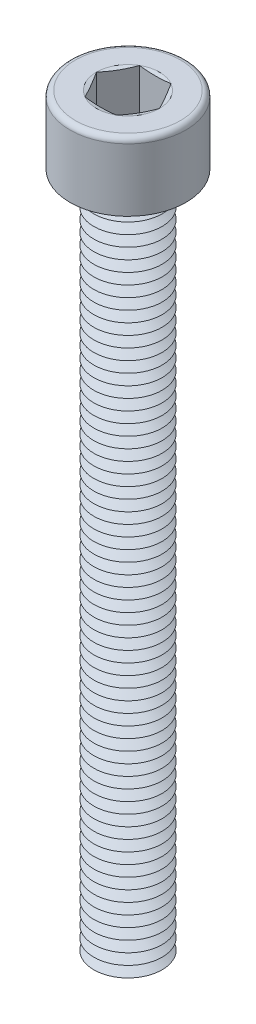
SolidWorks part; units mm, degrees
ref_plane "Front Plane" through (0, 0, 0) normal (0, 0, 1) x (1, 0, 0)
ref_plane "Top Plane" through (0, 0, 0) normal (0, 1, 0) x (1, 0, 0)
ref_plane "Right Plane" through (0, 0, 0) normal (1, 0, 0) x (0, 0, -1)
sketch "Sketch1" plane through (0, 0, 0) normal (0, 1, 0) x (1, 0, 0)
  circle A0 centre (0, 0) radius 2.5
  dimension "D1" = 5
extrude "Extrude1" add sketch "Sketch1" along normal blind 50
sketch "Sketch2" plane through (0, 50, 0) normal (0, 1, 0) x (1, 0, 0)
  circle A0 centre (0, 0) radius 4.25
  dimension "D1" = 8.5
extrude "Extrude2" add sketch "Sketch2" along normal blind 5
sketch "Sketch3" plane through (0, 55, 0) normal (0, 1, 0) x (1, 0, 0)
  line L1 (1.1547, 2) -> (-1.1547, 2)
  line L2 (-1.1547, 2) -> (-2.3094, 0)
  line L3 (-2.3094, 0) -> (-1.1547, -2)
  line L4 (-1.1547, -2) -> (1.1547, -2)
  line L5 (1.1547, -2) -> (2.3094, 0)
  line L6 (2.3094, 0) -> (1.1547, 2)
  circle A0 centre (0, 0) radius 2 construction
  dimension "D1" = 4
extrude "Extrude3" cut sketch "Sketch3" against normal blind 4
fillet "Fillet1" radius 0.4 1 edges at (0, 55, 4.25)
sketch "Sketch4" plane through (0, 0, 0) normal (1, 0, 0) x (0, 0, -1)
  line L0 (-2, 51) -> (0, 51)
  line L1 (0, 51) -> (0, 49.8453)
  line L2 (0, 49.8453) -> (-2, 51)
  dimension "D1" = 30
revolve "Cut-Revolve1" cut sketch "Sketch4" angle 360 about L1
sketch "Sketch5" plane through (0, 0, 0) normal (0, 0, 1) x (1, 0, 0)
  line L0 (-2.5, 0.4) -> (-2.5, -0.4)
  line L1 (-2.5, 50) -> (-2.5, 0) construction
  line L2 (-2.5, -0.4) -> (-1.8072, 0)
  line L3 (-2.5, 0) -> (2.5, 0) construction
  line L4 (-1.8072, 0) -> (-2.5, 0.4)
  dimension "D1" = 0.8
revolve "Cut-Revolve2" cut sketch "Sketch5" angle 360 about axis through (0, 50, 0) along (0, -1, 0)
pattern_linear "LPattern1" count 63 spacing 0.8 along (0, 1, 0) of "Cut-Revolve2"
sketch "Sketch6" plane through (0, 55, 0) normal (0, 1, 0) x (1, 0, 0)
  circle A0 centre (0, 0) radius 2.3094
extrude "Extrude4" cut sketch "Sketch6" against normal through all draft 75
